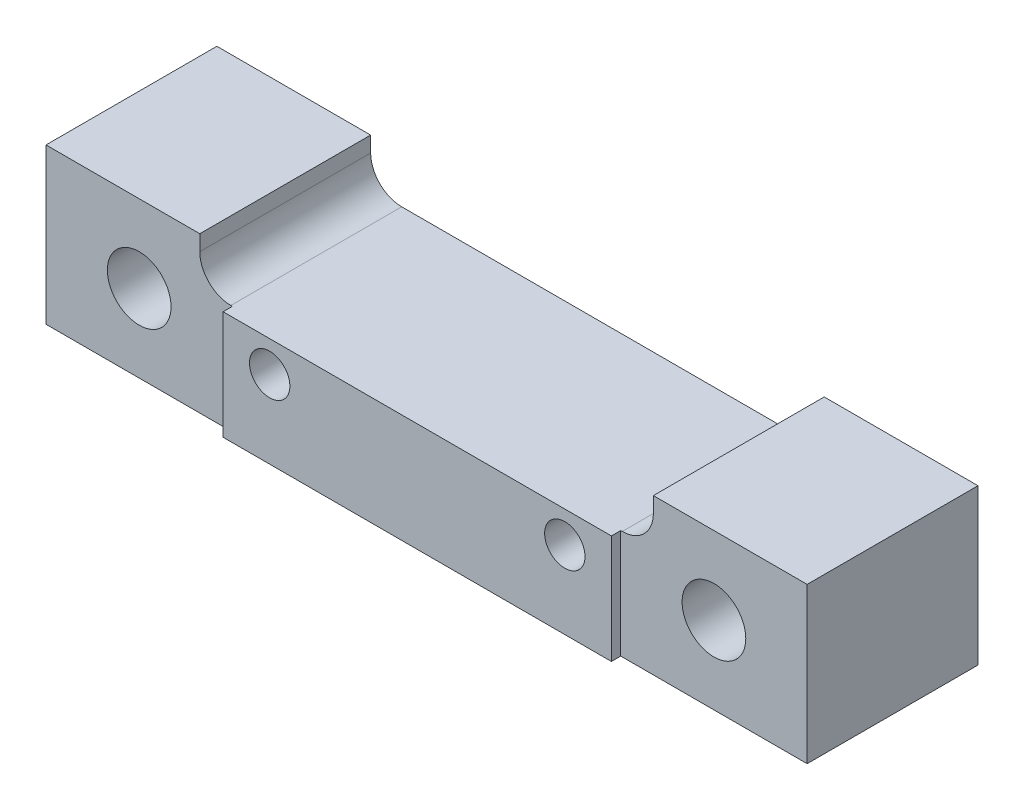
SolidWorks part; units mm, degrees
ref_plane "Frontal" through (0, 0, 0) normal (0, 0, 1) x (1, 0, 0)
ref_plane "Horizontal" through (0, 0, 0) normal (0, 1, 0) x (1, 0, 0)
ref_plane "Vertical" through (0, 0, 0) normal (1, 0, 0) x (0, 0, -1)
imported_body "Importée1"
sketch "Esquisse1" plane through (0, 0, 0) normal (0, 0, -1) x (-1, 0, 0)
  line L0 (92.5, 0) -> (-92.5, 0) construction
  point P4 (0, 0)
other "SupprimerFace1"
sketch "Esquisse2" plane through (0, 0, 0) normal (0, 0, -1) x (-1, 0, 0)
  line L0 (0, 0) -> (0, -18.9677) construction
  line L1 (92.5, 0) -> (-92.5, 0) construction
  circle A0 centre (47.5, 0) radius 6.5
  circle A1 centre (-47.5, 0) radius 6.5
  dimension "D1" = 13
  dimension "D2" = 95
extrude "Extrusion1" cut sketch "Esquisse2" against normal through all
